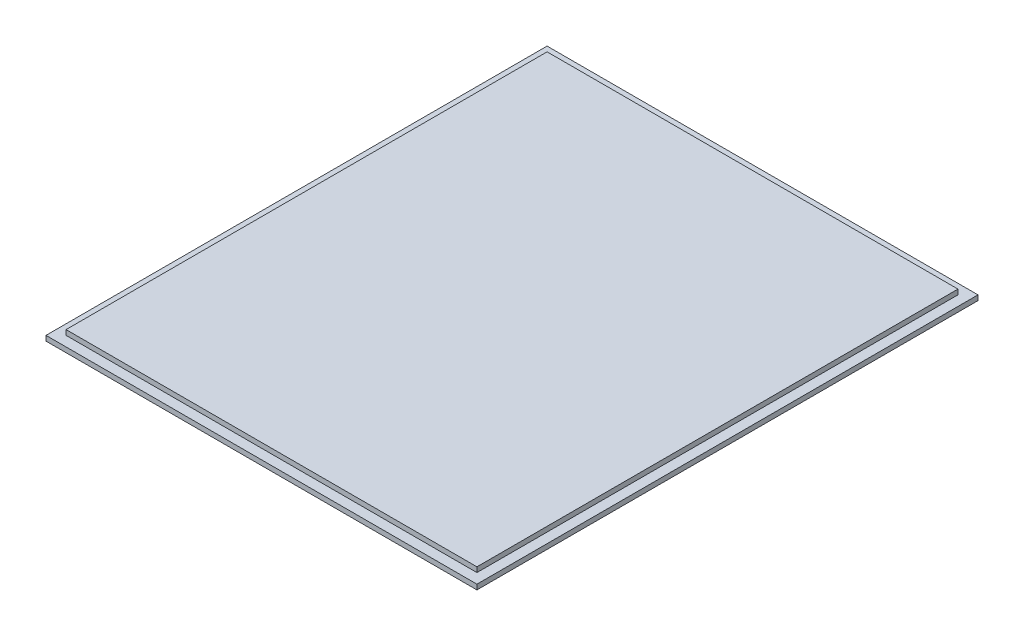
SolidWorks part; units mm, degrees
ref_plane "Front Plane" through (0, 0, 0) normal (0, 0, 1) x (1, 0, 0)
ref_plane "Top Plane" through (0, 0, 0) normal (0, 1, 0) x (1, 0, 0)
ref_plane "Right Plane" through (0, 0, 0) normal (1, 0, 0) x (0, 0, -1)
sketch "Sketch1" plane through (0, 0, 0) normal (0, 1, 0) x (1, 0, 0)
  line L1 (-136.525, 158.75) -> (136.525, 158.75)
  line L2 (-136.525, 158.75) -> (-136.525, -158.75)
  line L3 (-136.525, -158.75) -> (136.525, -158.75)
  line L4 (136.525, 158.75) -> (136.525, -158.75)
  line L5 (-136.525, 158.75) -> (136.525, -158.75) construction
  line L6 (-136.525, -158.75) -> (136.525, 158.75) construction
  point P0 (0, 0)
extrude "Boss-Extrude1" add sketch "Sketch1" along normal blind 6.35
sketch "Sketch2" plane through (0, 6.35, 0) normal (0, 1, 0) x (1, 0, 0)
  line L1 (-130.175, -152.4) -> (130.175, -152.4)
  line L2 (-130.175, -152.4) -> (-130.175, 152.4)
  line L3 (-130.175, 152.4) -> (130.175, 152.4)
  line L4 (130.175, -152.4) -> (130.175, 152.4)
  line L5 (-130.175, -152.4) -> (130.175, 152.4) construction
  line L6 (-130.175, 152.4) -> (130.175, -152.4) construction
  point P0 (0, 0)
extrude "Cut-Extrude1" cut sketch "Sketch2" against normal blind 3.175 flip side to cut
